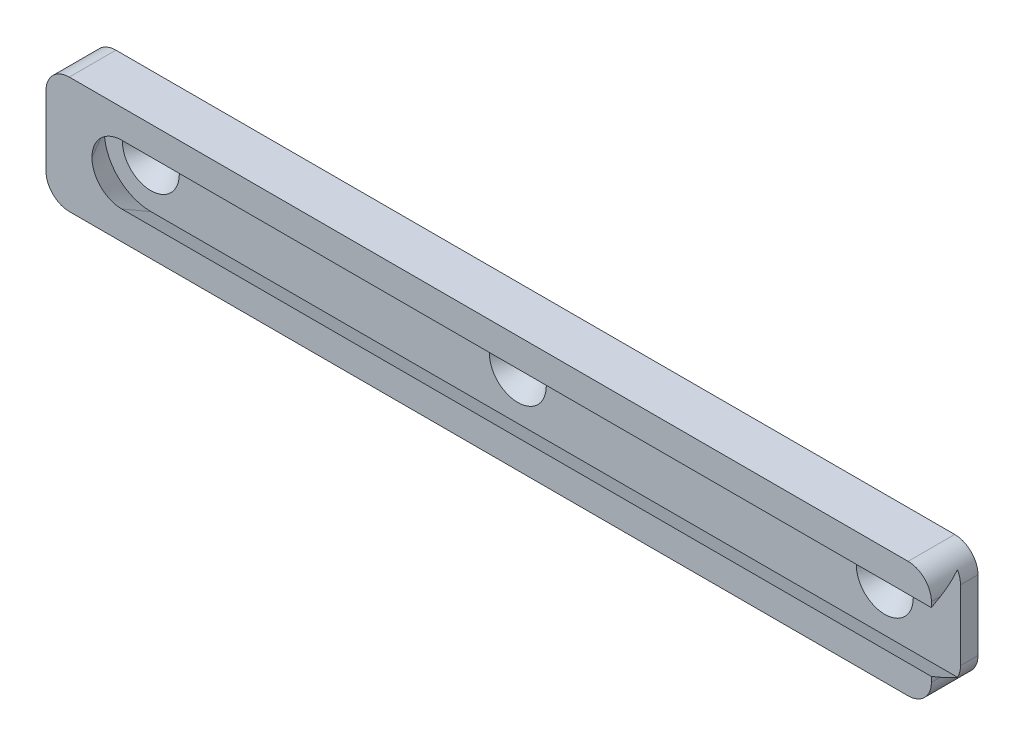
SolidWorks part; units mm, degrees
ref_plane "Front" through (0, 0, 0) normal (0, 0, 1) x (1, 0, 0)
ref_plane "Top" through (0, 0, 0) normal (0, 1, 0) x (1, 0, 0)
ref_plane "Right" through (0, 0, 0) normal (1, 0, 0) x (0, 0, -1)
sketch "Sketch1" plane through (0, 0, 0) normal (0, 0, 1) x (1, 0, 0)
  line L0 (0, 0) -> (-91.6833, 0) construction
  line L1 (-152, 10) -> (0, 10)
  line L2 (-152, 10) -> (-152, -10)
  line L3 (-152, -10) -> (0, -10)
  line L4 (0, 10) -> (0, -10)
  dimension "D1" = 20
  dimension "D2" = 152
extrude "Extrude1" add sketch "Sketch1" along normal blind 5
sketch "Sketch2" plane through (0, 0, 0) normal (0, 0, -1) x (-1, 0, 0)
  line L0 (0, -10) -> (0, 10) construction
  line L1 (0, 3) -> (142, 3)
  line L2 (0, 3) -> (0, -3)
  line L3 (0, -3) -> (142, -3)
  line L4 (142, 3) -> (142, -3)
  dimension "D1" = 6
  dimension "D2" = 142
extrude "Extrude2" cut sketch "Sketch2" against normal through all
fillet "Fillet1" radius 3 2 edges at (-142, -3, 2.5) (-142, 3, 2.5)
chamfer "Chamfer1" distance 5 angle 60 4 edges at (-69.5, -3, 0) (-141.1213, -2.1213, 0) (-141.1213, 2.1213, 0) (-69.5, 3, 0)
sketch "Sketch3" plane through (0, 0, 0) normal (0, 0, 1) x (1, 0, 0)
  line L1 (0, -10) -> (-152, -10)
  line L2 (0, -10) -> (0, 10)
  line L3 (0, 10) -> (-152, 10)
  line L4 (-152, -10) -> (-152, 10)
extrude "Extrude3" add sketch "Sketch3" against normal blind 3
fillet "Fillet2" radius 4 4 edges at (0, -10, 1) (0, 10, 1) (-152, -10, 1) (-152, 10, 1)
hole_wizard "CSK for #10 Flat Head Machine Screw1" positions "Sketch5" profile "Sketch4" countersink size "#10" standard "ANSI Inch"
sketch "Sketch5" plane through (0, 0, 0) normal (0, 0, 1) x (1, 0, 0)
  line L0 (-10.5859, 0) -> (-139, 0) construction
  line L1 (-76, 83.2435) -> (-76, -17.8741) construction
  point P0 (-139, 0)
  point P3 (-76, 0)
  point P6 (-13, 0)
sketch "Sketch4" plane through (-139, 0, 0) normal (1, 0, 0) x (0, -1, 0)
  line L0 (0, 0) -> (0, 3)
  line L1 (0, 3) -> (2.5527, 3)
  line L2 (2.5527, 3) -> (2.5527, 2.6882)
  line L3 (2.5527, 2.6882) -> (4.8895, 0)
  line L5 (4.8895, 0) -> (0, 0)
  line L6 (-2.5527, 2.6882) -> (-4.8895, 0) construction
  line L11 (0, -6.35) -> (0, 107.95) construction
  dimension "Thru Hole Dia." = 5.1054
  dimension "Thru Hole Depth" = 3
  dimension "Near C'Sink Dia." = 9.779
  dimension "Near C'Sink Angle" = 82
